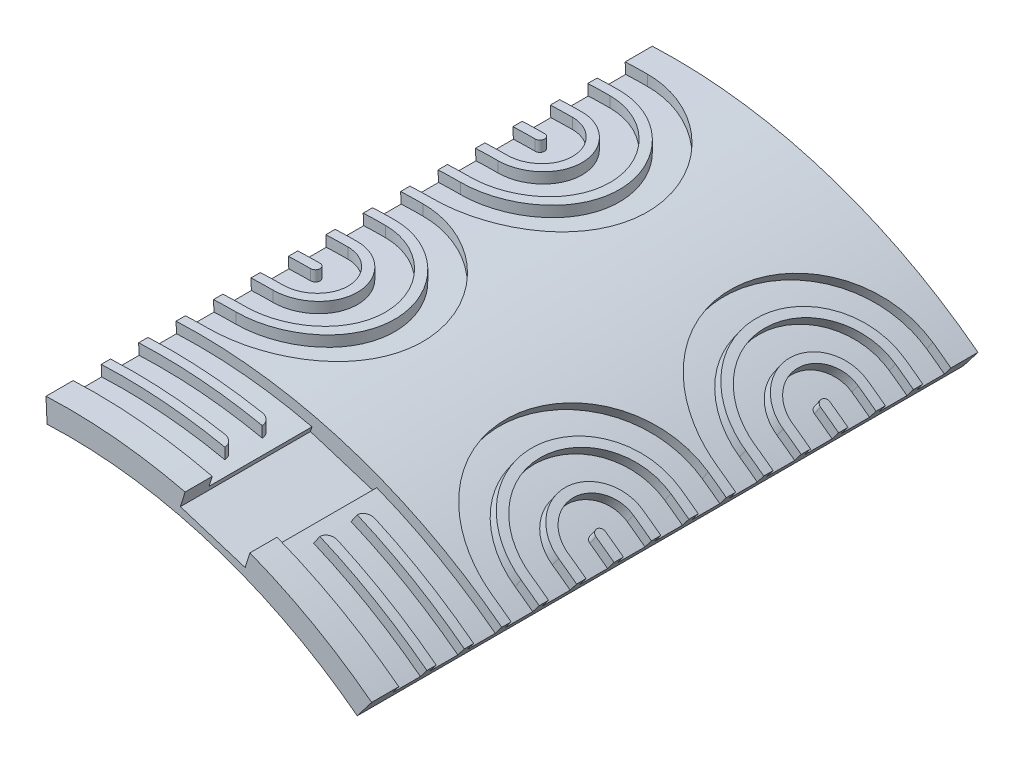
SolidWorks part; units mm, degrees
ref_plane "Přední rovina" through (0, 0, 0) normal (0, 0, 1) x (1, 0, 0)
ref_plane "Horní rovina" through (0, 0, 0) normal (0, 1, 0) x (1, 0, 0)
ref_plane "Pravá rovina" through (0, 0, 0) normal (1, 0, 0) x (0, 0, -1)
sketch "Skica1" plane through (0, 0, 0) normal (0, 0, 1) x (1, 0, 0)
  line L1 (140, -140) -> (-140, -140)
  line L2 (140, -140) -> (140, 140)
  line L3 (140, 140) -> (-140, 140)
  line L4 (-140, -140) -> (-140, 140)
  line L5 (140, -140) -> (-140, 140) construction
  line L6 (140, 140) -> (-140, -140) construction
  point P0 (0, 0)
  dimension "D1" = 280
  dimension "D2" = 280
extrude "Přidat vysunutím1" add sketch "Skica1" along normal blind 162
sketch "Skica2" plane through (0, 140, 0) normal (0, 1, 0) x (1, 0, 0)
  line L0 (-140, 0) -> (-140, -7.25)
  line L1 (-140, -162) -> (-140, 0) construction
  line L2 (-140, -7.25) -> (-140, -14.75)
  line L3 (-140, -14.75) -> (-140, -17.25)
  line L4 (-140, -17.25) -> (-140, -24.75)
  line L5 (-140, -24.75) -> (0, -24.75)
  line L6 (-140, -24.75) -> (-140, -27.25)
  line L7 (-140, -27.25) -> (0, -27.25)
  line L8 (-140, -27.25) -> (-140, -34.75)
  line L9 (-140, -34.75) -> (0, -34.75)
  line L10 (-140, -14.75) -> (0, -14.75)
  line L11 (-140, -37.25) -> (0, -37.25)
  line L12 (-140, -7.25) -> (0, -7.25)
  line L13 (-140, -17.25) -> (0, -17.25)
  line L14 (-140, -34.75) -> (-140, -36)
  line L15 (-140, -36) -> (140, -36) construction
  line L16 (140, -162) -> (140, 0) construction
  line L17 (0, 0) -> (0, -36) construction
  line L18 (-140, -44.75) -> (0, -44.75)
  line L19 (-140, -47.25) -> (0, -47.25)
  line L20 (-140, -54.75) -> (0, -54.75)
  line L21 (-140, -64.75) -> (0, -64.75)
  line L22 (-140, -57.25) -> (0, -57.25)
  line L23 (-140, -64.75) -> (-140, -67.25)
  line L24 (-140, -67.25) -> (-140, -74.75)
  line L25 (-140, -74.75) -> (-140, -77.25)
  line L26 (-140, -77.25) -> (-140, -84.75)
  line L27 (-140, -84.75) -> (0, -84.75)
  line L28 (-140, -84.75) -> (-140, -87.25)
  line L29 (-140, -87.25) -> (0, -87.25)
  line L30 (-140, -87.25) -> (-140, -94.75)
  line L31 (-140, -94.75) -> (0, -94.75)
  line L32 (-140, -74.75) -> (0, -74.75)
  line L33 (-140, -97.25) -> (0, -97.25)
  line L34 (-140, -67.25) -> (0, -67.25)
  line L35 (-140, -77.25) -> (0, -77.25)
  line L36 (-140, -94.75) -> (-140, -96)
  line L37 (0, -59.75) -> (0, -96) construction
  line L38 (-140, -104.75) -> (0, -104.75)
  line L39 (-140, -107.25) -> (0, -107.25)
  line L40 (-140, -114.75) -> (0, -114.75)
  line L41 (-140, -124.75) -> (0, -124.75)
  line L42 (-140, -117.25) -> (0, -117.25)
  line L43 (0, 0) -> (40, 0) construction
  line L44 (140, 0) -> (-140, 0) construction
  line L45 (40, 0) -> (40, -154.75) construction
  line L46 (140, -162) -> (-140, -162) construction
  line L47 (-140, -124.75) -> (-140, -127.25)
  line L48 (-140, -127.25) -> (32.8902, -127.25)
  line L49 (-140, -127.25) -> (-140, -134.75)
  line L50 (-140, -134.75) -> (24.5559, -134.75)
  line L51 (-140, -134.75) -> (-140, -137.25)
  line L52 (-140, -137.25) -> (-140, -144.75)
  line L53 (-140, -137.25) -> (27.0559, -137.25)
  line L54 (-140, -144.75) -> (24.5559, -144.75)
  line L55 (-140, -144.75) -> (-140, -147.25)
  line L56 (-140, -147.25) -> (27.0559, -147.25)
  line L57 (-140, -147.25) -> (-140, -154.75)
  line L58 (-140, -154.75) -> (30.93, -154.75)
  line L59 (30.93, -154.75) -> (40, -154.75)
  line L60 (40, -154.75) -> (40, -127.25)
  arc A0 (0, -27.25) -> (0, -44.75) centre (0, -36) cw
  arc A1 (0, -24.75) -> (0, -47.25) centre (0, -36) cw
  arc A2 (0, -17.25) -> (0, -54.75) centre (0, -36) cw
  arc A3 (0, -14.75) -> (0, -57.25) centre (0, -36) cw
  arc A4 (0, -7.25) -> (0, -64.75) centre (0, -36) cw
  arc A5 (1.25, -36) -> (0, -34.75) centre (0, -36) ccw
  arc A6 (0, -37.25) -> (1.25, -36) centre (0, -36) ccw
  arc A7 (0, -87.25) -> (0, -104.75) centre (0, -96) cw
  arc A8 (0, -84.75) -> (0, -107.25) centre (0, -96) cw
  arc A9 (0, -77.25) -> (0, -114.75) centre (0, -96) cw
  arc A10 (0, -74.75) -> (0, -117.25) centre (0, -96) cw
  arc A11 (0, -67.25) -> (0, -124.75) centre (0, -96) cw
  arc A12 (1.25, -96) -> (0, -94.75) centre (0, -96) ccw
  arc A13 (0, -97.25) -> (1.25, -96) centre (0, -96) ccw
  arc A15 (40, -134.75) -> (32.0884, -127.25) centre (32.4893, -134.75) ccw
  arc A16 (27.0559, -137.25) -> (24.5559, -134.75) centre (24.5559, -137.25) ccw
  arc A17 (27.0559, -147.25) -> (24.5559, -144.75) centre (24.5559, -147.25) ccw
  dimension "D8" = 28.75
  dimension "D9" = 21.25
  dimension "D10" = 18.75
  dimension "D11" = 11.25
  dimension "D12" = 8.75
  dimension "D13" = 28.75
  dimension "D40" = 21.25
  dimension "D41" = 18.75
  dimension "D42" = 11.25
  dimension "D43" = 8.75
  dimension "D44" = 1.25
  dimension "D1" = 7.25
  dimension "D2" = 7.5
  dimension "D3" = 2.5
  dimension "D5" = 2.5
  dimension "D4" = 7.5
  dimension "D6" = 7.5
  dimension "D7" = 1.25
  dimension "D14" = 2.5
  dimension "D15" = 40
  dimension "D16" = 2.5
  dimension "D17" = 7.5
  dimension "D18" = 2.5
  dimension "D19" = 7.5
  dimension "D20" = 2.5
  dimension "D21" = 7.5
  dimension "D22" = 7.25
  dimension "D23" = 7.5
  dimension "D24" = 2.5
  dimension "D25" = 7.5
  dimension "D26" = 2.5
  dimension "D27" = 7.5
  dimension "D28" = 2.5
  dimension "D29" = 7.5
  dimension "D30" = 2.5
  dimension "D31" = 7.5
  dimension "D32" = 2.5
  dimension "D33" = 7.5
  dimension "D34" = 7.5
  dimension "D35" = 2.5
  dimension "D36" = 7.5
  dimension "D37" = 2.5
  dimension "D38" = 7.5
  dimension "D39" = 2.5
extrude "Odebrat vysunutím1" cut sketch "Skica2" against normal through all
sketch "Skica3" plane through (0, 0, 0) normal (0, 0, -1) x (-1, 0, 0)
  line L0 (0, 0) -> (-40, 0)
  line L1 (-140, 140) -> (140, 140)
  line L2 (-140, 140) -> (-140, -140)
  line L3 (-140, -140) -> (140, -140)
  line L4 (140, 140) -> (140, -140)
  line L6 (0, 0) -> (-40, 127.3666)
  line L7 (0, 0) -> (5.9742, 133.3663)
  line L8 (-40, -140) -> (-40, 140) construction
  circle A0 centre (0, 0) radius 130.5
  circle A1 centre (0, 0) radius 133.5
  dimension "D1" = 261
  dimension "D2" = 267
  dimension "D3" = 40
  dimension "D4" = 20
extrude "Odebrat vysunutím3" cut sketch "Skica3" against normal through all
ref_plane "Rovina3" through (0, 0, 0) normal (0.9541, -0.2996, 0) x (0, 0, -1)
mirror "Zrcadlit10" about plane through (0, 0, 0) normal (0.9541, -0.2996, 0)
sketch "Skica5" plane through (0, 0, 162) normal (0, 0, 1) x (1, 0, 0)
  line L0 (0, 0) -> (-5.9742, 133.3663)
  line L1 (-5.9742, 133.3663) -> (-6.1309, 136.8628)
  line L2 (0, 0) -> (39.1011, 124.5044)
  line L3 (39.1011, 124.5044) -> (41.0487, 130.7058)
  line L4 (0, 0) -> (79.3261, 103.6225)
  line L5 (79.3261, 103.6225) -> (83.2772, 108.7838)
  circle A0 centre (0, 0) radius 137
  circle A1 centre (0, 0) radius 127
  circle A2 centre (0, 0) radius 130.5
  circle A3 centre (0, 0) radius 133.5
  dimension "D1" = 254
  dimension "D2" = 274
extrude "Přidat vysunutím2" add sketch "Skica5" against normal through all contours A1 L2 L0 M1 | L4 A2 L2 A1 | A3 L5 A0 L3 | L3 A0 L1 M3
sketch "Skica9" plane through (0, 0, 162) normal (0, 0, 1) x (1, 0, 0)
  line L0 (0, 0) -> (40.4494, 128.7977)
  line L1 (-16.4794, -52.4731) -> (16.4794, 52.4731) construction
  line L2 (40.4494, 128.7977) -> (38.5948, 122.8921)
  line L3 (40.4494, 128.7977) -> (38.5948, 122.8921)
  line L4 (31.7961, 131.5153) -> (49.1027, 126.0801)
  line L5 (29.9415, 125.6097) -> (47.2481, 120.1745)
  line L6 (49.1027, 126.0801) -> (47.2481, 120.1745)
  line L7 (31.7961, 131.5153) -> (29.9415, 125.6097)
  circle A0 centre (0, 0) radius 135
  dimension "D1" = 270
  dimension "D2" = 6.19
  dimension "D3" = 9.07
extrude "Odebrat vysunutím4" cut sketch "Skica9" against normal blind 34.75 contours L0 A0 L7 L5 | L6 A0 L0 L5 | A0 L6 L4 | A0 L4 L7
scale "Měřítko1" scale about centroid uniform scaling yes scale factor 0.655
sketch "Skica10" plane through (0, 0, 27.068) normal (0, 0, -1) x (-1, 0, 0)
  line L0 (-66.5394, 112.0602) -> (-65.345, 110.4999) construction
  line L1 (-66.5394, 112.0602) -> (-65.345, 110.4999)
  line L2 (-9.6638, 125.7288) -> (-9.3707, 132.2723)
  line L3 (-67.933, 113.8805) -> (-63.9515, 108.6796)
  line L4 (-9.6638, 125.7288) -> (-9.3707, 132.2723)
  line L5 (-67.933, 113.8805) -> (-63.9515, 108.6796)
  line L6 (-63.9515, 108.6796) -> (-67.933, 113.8805) construction
  circle A0 centre (-13.3864, 42.6272) radius 87.3425
  arc A2 (-9.3707, 132.2723) -> (-67.933, 113.8805) centre (-13.3864, 42.6272) ccw
  arc A3 (-9.6638, 125.7288) -> (-63.9515, 108.6796) centre (-13.3864, 42.6272) ccw
  arc A4 (-9.3707, 132.2723) -> (-67.933, 113.8805) centre (-13.3864, 42.6272) ccw
  arc A5 (-9.6638, 125.7288) -> (-63.9515, 108.6796) centre (-13.3864, 42.6272) ccw
  point P9 (-66.4786, 111.9808)
  point P10 (-66.1727, 111.5811)
  dimension "D2" = 0.1
  dimension "D1" = 0
extrude "Odebrat vysunutím5" cut sketch "Skica10" against normal through all contours A0 L4 M6 M7
